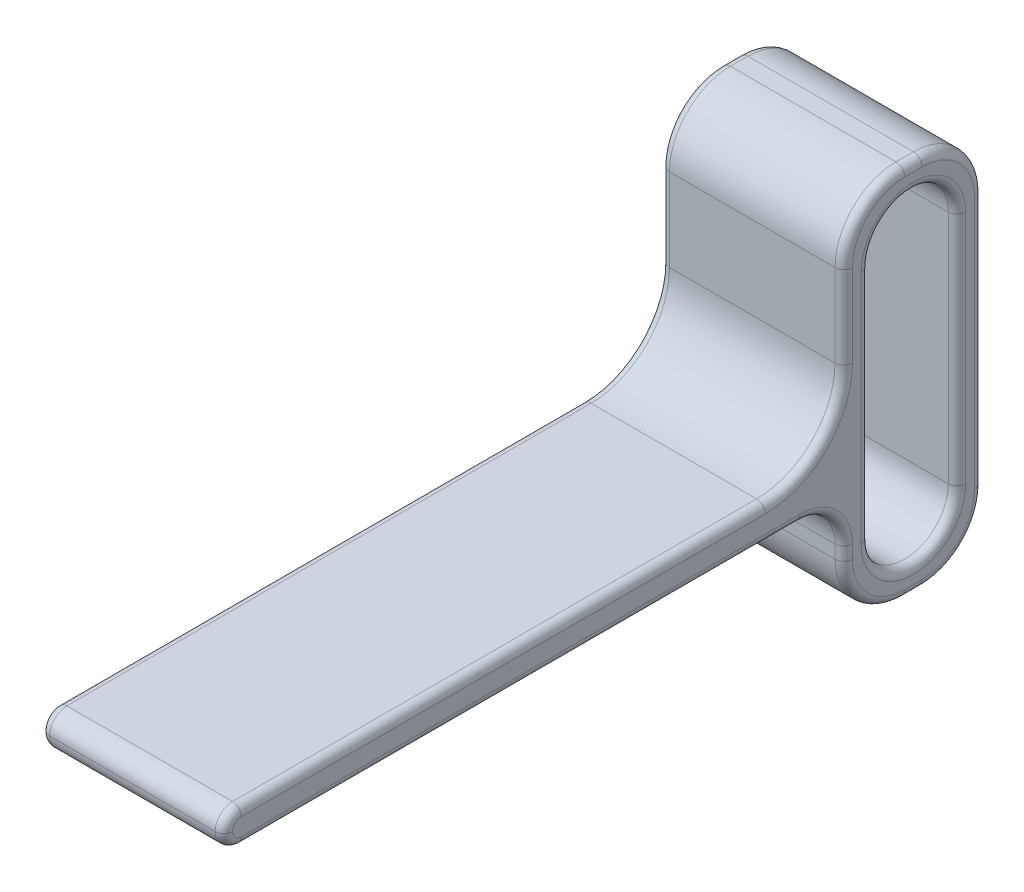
SolidWorks part; units mm, degrees
ref_plane "Front Plane" through (0, 0, 0) normal (0, 0, 1) x (1, 0, 0)
ref_plane "Top Plane" through (0, 0, 0) normal (0, 1, 0) x (1, 0, 0)
ref_plane "Right Plane" through (0, 0, 0) normal (1, 0, 0) x (0, 0, -1)
sketch "Sketch1" plane through (0, 0, 0) normal (0, 0, 1) x (1, 0, 0)
  line L1 (-10.5, 3) -> (10.5, 3)
  line L2 (-10.5, 3) -> (-10.5, -3)
  line L3 (-10.5, -3) -> (10.5, -3)
  line L4 (10.5, 3) -> (10.5, -3)
  line L5 (-10.5, 3) -> (10.5, -3) construction
  line L6 (-10.5, -3) -> (10.5, 3) construction
  point P0 (0, 0)
  dimension "D1" = 21
  dimension "D2" = 6
extrude "Boss-Extrude1" add sketch "Sketch1" along normal blind 60
sketch "Sketch3" plane through (10.5, 0, 0) normal (1, 0, 0) x (0, 0, -1)
  line L0 (0, 3) -> (13.5776, 3) construction
  line L1 (0, -3) -> (3.4641, 3)
  line L2 (3.4641, 3) -> (0, 3)
  line L3 (0, 3) -> (0, -3)
  line L4 (0, -3) -> (0.1328, -2.9943)
  dimension "D1" = 30
extrude "Boss-Extrude3" add sketch "Sketch3" against normal up to surface (21 mm away) contours L1 L2 L3
sketch "Sketch4" plane through (10.5, 0, 0) normal (1, 0, 0) x (0, 0, -1)
  line L0 (3.4641, 3) -> (8.9678, 12.5327) construction
  line L1 (0, -3) -> (9.6169, -3) construction
  line L2 (0, -3) -> (6.9282, -3)
  line L3 (6.9282, -3) -> (15.4603, 11.7779)
  line L4 (15.4603, 11.7779) -> (10.2641, 14.7779)
  line L5 (10.2641, 14.7779) -> (0, -3)
  dimension "D1" = 13.6
  dimension "D2" = 6
extrude "Boss-Extrude4" add sketch "Sketch4" against normal up to surface (21 mm away)
sketch "Sketch10" plane through (10.5, 0, 0) normal (1, 0, 0) x (0, 0, -1)
  line L0 (6.9282, -3) -> (26.9282, -3)
  line L1 (26.9282, -3) -> (26.9282, 0)
  line L2 (26.9282, 0) -> (8.6603, 0)
  line L3 (6.9282, -3) -> (15.4603, 11.7779) construction
  line L4 (8.6603, 0) -> (6.9282, -3)
  dimension "D1" = 20
extrude "Boss-Extrude7" add sketch "Sketch10" against normal up to surface (21 mm away)
sketch "Sketch11" plane through (0, -3, 0) normal (0, -1, 0) x (1, 0, 0)
  line L1 (-10.5, 60) -> (10.5, 60)
  line L2 (-10.5, 60) -> (-10.5, -26.9282)
  line L3 (-10.5, -26.9282) -> (10.5, -26.9282)
  line L4 (10.5, 60) -> (10.5, -26.9282)
extrude "Cut-Extrude4" cut sketch "Sketch11" against normal blind 2
sketch "Sketch13" plane through (10.5, 0, 0) normal (1, 0, 0) x (0, 0, -1)
  line L0 (-60, -1) -> (-40, -1)
  line L1 (26.9282, -1) -> (-60, -1) construction
  line L2 (-40, -1) -> (-40, -2.1)
  line L3 (-40, -2.1) -> (-58.0947, -2.1)
  line L4 (-58.0947, -2.1) -> (-60, -1)
  line L5 (10.2641, 14.7779) -> (3.4641, 3) construction
  line L6 (3.4641, 3) -> (-3.6242, -9.2774) construction
  line L7 (1.1547, -1) -> (-4.8453, -1)
  line L8 (-4.8453, -1) -> (-2.94, -2.1)
  line L9 (-2.94, -2.1) -> (1.1547, -2.1)
  line L10 (1.1547, -2.1) -> (1.1547, -1)
  dimension "D1" = 30
  dimension "D2" = 30
  dimension "D3" = 20
  dimension "D4" = 1.1
  dimension "D5" = 1.1
  dimension "D6" = 6
extrude "Boss-Extrude8" add sketch "Sketch13" against normal up to surface (21 mm away)
sketch "Sketch18" plane through (10.5, 0, 0) normal (1, 0, 0) x (0, 0, -1)
  line L0 (1.1547, -1) -> (26.9282, -1) construction
  line L1 (26.9282, -1) -> (46.9617, -1) construction
  line L2 (15.4603, 11.7779) -> (37.5923, -1)
  line L3 (37.5923, -1) -> (26.9282, -1)
  line L4 (26.9282, 0) -> (8.6603, 0)
  line L5 (8.6603, 0) -> (15.4603, 11.7779)
  line L21 (1.1547, -1) -> (26.9282, -1)
  line L22 (26.9282, -1) -> (26.9282, 0)
  line L23 (26.9282, 0) -> (8.6603, 0)
  line L24 (8.6603, 0) -> (15.4603, 11.7779)
  line L25 (15.4603, 11.7779) -> (10.2641, 14.7779)
  line L26 (10.2641, 14.7779) -> (3.4641, 3)
  line L27 (3.4641, 3) -> (-60, 3)
  line L28 (-60, 3) -> (-60, -1)
  line L29 (-60, -1) -> (-58.0947, -2.1)
  line L30 (-58.0947, -2.1) -> (-40, -2.1)
  line L31 (-40, -2.1) -> (-40, -1)
  line L32 (-40, -1) -> (-4.8453, -1)
  line L33 (-4.8453, -1) -> (-2.94, -2.1)
  line L34 (-2.94, -2.1) -> (1.1547, -2.1)
  line L35 (1.1547, -2.1) -> (1.1547, -1)
  line L37 (26.9282, -1) -> (26.9282, 0)
  dimension "D1" = 0
extrude "Boss-Extrude10" add sketch "Sketch18" against normal up to surface (21 mm away)
sketch "Sketch19" plane through (10.5, 0, 0) normal (1, 0, 0) x (0, 0, -1)
  line L0 (3.4641, 3) -> (10.2641, 14.7779) construction
  line L1 (10.2641, 14.7779) -> (32.6409, 53.5357) construction
  line L2 (1.1547, -1) -> (37.5923, -1) construction
  line L3 (37.5923, -1) -> (68.3524, 0) construction
  line L4 (10.2641, 14.7779) -> (20.3337, 32.2191)
  line L5 (37.5923, -1) -> (40.1888, -0.9156)
  circle A0 centre (29.5883, 15.2485) radius 12.5
  arc A1 (40.1888, -0.9156) -> (20.3337, 32.2191) centre (29.5883, 15.2485) ccw
  dimension "D1" = 25
  dimension "D2" = 16.5
  dimension "D3" = 16.5
extrude "Boss-Extrude11" add sketch "Sketch19" against normal up to surface (21 mm away) contours L5 A1 L4 A0 M4
sketch "Sketch20" plane through (10.5, 0, 0) normal (1, 0, 0) x (0, 0, -1)
  circle A0 centre (29.5883, 15.2485) radius 12.5
extrude "Cut-Extrude6" cut sketch "Sketch20" against normal through all
sketch "Sketch21" plane through (10.5, 0, 0) normal (1, 0, 0) x (0, 0, -1)
  line L0 (3.4641, 3) -> (1.1547, -1) construction
  line L1 (3.4641, 3) -> (12.8205, 3)
  line L2 (12.8205, 3) -> (12.8205, -1)
  line L3 (37.5923, -1) -> (1.1547, -1) construction
  line L4 (12.8205, -1) -> (68.056, -1)
  line L5 (68.056, -1) -> (68.056, 55.6949)
  line L6 (68.056, 55.6949) -> (3.4641, 55.6949)
  line L7 (3.4641, 55.6949) -> (3.4641, 3)
extrude "Cut-Extrude7" cut sketch "Sketch21" against normal through all
sketch "Sketch22" plane through (10.5, 0, 0) normal (1, 0, 0) x (0, 0, -1)
  line L0 (1.1547, -1) -> (12.7434, 19.0723) construction
  line L1 (12.8205, -1) -> (1.1547, -1) construction
  line L2 (11.1547, -1) -> (11.1547, 3)
  line L3 (-60, 3) -> (12.8205, 3) construction
  line L4 (11.1547, 3) -> (12.8205, 3)
  line L5 (12.8205, 3) -> (12.8205, -1)
  line L6 (12.8205, -1) -> (11.1547, -1)
  dimension "D1" = 60
  dimension "D2" = 10
extrude "Cut-Extrude8" cut sketch "Sketch22" against normal through all
sketch "Sketch23" plane through (10.5, 0, 0) normal (1, 0, 0) x (0, 0, -1)
  line L0 (14.1547, 7) -> (24.1547, 7) construction
  line L1 (11.1547, 28.5) -> (27.1547, 28.5)
  line L2 (11.1547, 28.5) -> (11.1547, -14.5)
  line L3 (11.1547, -14.5) -> (27.1547, -14.5)
  line L4 (27.1547, 28.5) -> (27.1547, -14.5)
  line L6 (14.1547, -6.5) -> (14.1547, 20.5)
  line L8 (24.1547, -6.5) -> (24.1547, 20.5)
  arc A0 (14.1547, -6.5) -> (24.1547, -6.5) centre (19.1547, -6.5) ccw
  arc A1 (14.1547, 20.5) -> (24.1547, 20.5) centre (19.1547, 20.5) cw
  dimension "D5" = 8
  dimension "D7" = 5
  dimension "D1" = 25.5
  dimension "D2" = 13.5
  dimension "D3" = 16
  dimension "D4" = 3
  dimension "D6" = 3
  dimension "D8" = 8
  dimension "D9" = 8
extrude "Boss-Extrude12" add sketch "Sketch23" against normal up to surface (21 mm away)
sketch "Sketch25" plane through (10.5, 0, 0) normal (1, 0, 0) x (0, 0, -1)
  line L1 (1.1547, -1) -> (-67.4888, -1)
  line L2 (1.1547, -1) -> (1.1547, -13.0841)
  line L3 (1.1547, -13.0841) -> (-67.4888, -13.0841)
  line L4 (-67.4888, -1) -> (-67.4888, -13.0841)
extrude "Cut-Extrude10" cut sketch "Sketch25" against normal through all
fillet "Fillet1" radius 7 4 edges at (0, -14.5, -27.1547) (0, -14.5, -11.1547) (0, 28.5, -27.1547) (0, 28.5, -11.1547)
fillet "Fillet2" radius 5 1 edges
fillet "Fillet3" radius 9 1 edges
fillet "Fillet4" radius 2 2 edges at (0, -1, 60) (0, 3, 60)
fillet "Fillet5" radius 1 38 edges at (-10.5, 25.5, -19.1547) (10.5, 25.5, -19.1547) (-10.5, 7, -24.1547) (10.5, 7, -24.1547) (-10.5, -11.5, -19.1547) (10.5, -11.5, -19.1547) (-10.5, -12.4497, -13.205) (-10.5, -2.4645, -9.6902) (-10.5, -0.4142, 59.4142) (-10.5, 2.4142, 59.4142) (-10.5, 26.4497, -13.205) (-10.5, 5.636, -8.5187) (10.5, -12.4497, -13.205) (10.5, -2.4645, -9.6902) (10.5, -0.4142, 59.4142) (10.5, 2.4142, 59.4142) (10.5, 26.4497, -13.205) (10.5, 5.636, -8.5187) (-10.5, 7, -14.1547) (10.5, 7, -14.1547) (-10.5, -14.5, -19.1547) (10.5, -14.5, -19.1547) (-10.5, -12.4497, -25.1044) (10.5, 7, -27.1547) (-10.5, 7, -27.1547) (-10.5, 26.4497, -25.1044) (10.5, 28.5, -19.1547) (-10.5, 28.5, -19.1547) (10.5, -12.4497, -25.1044) (10.5, 26.4497, -25.1044)
